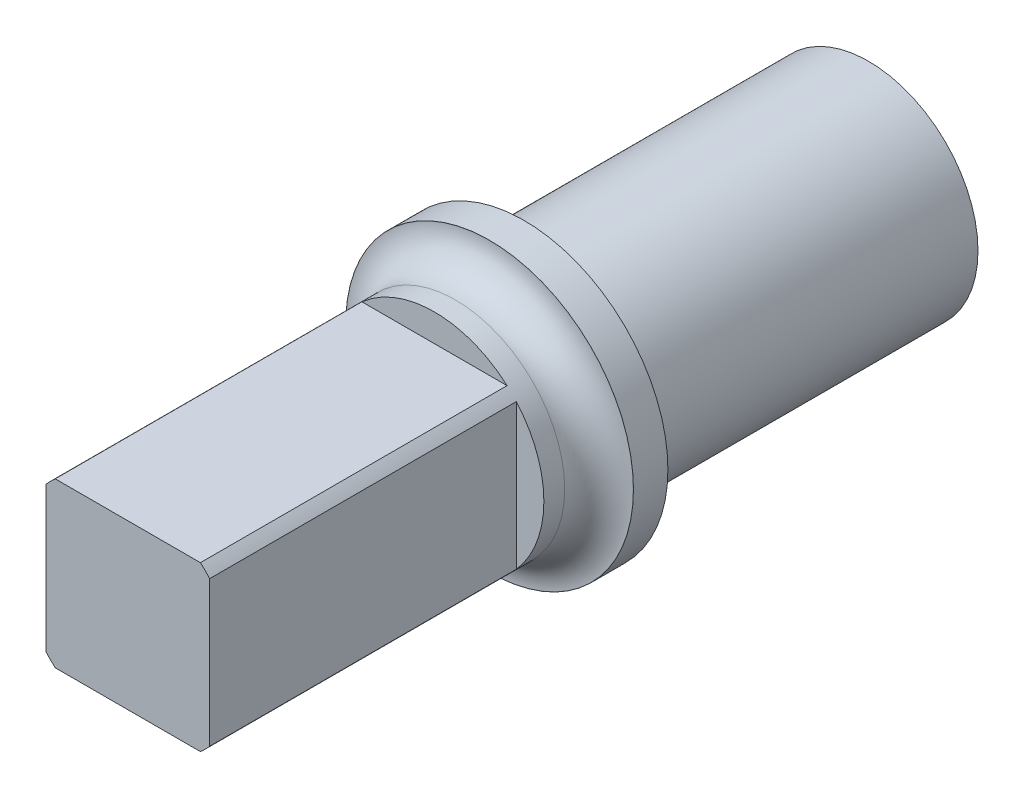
SolidWorks part; units mm, degrees
ref_plane "Спереди" through (0, 0, 0) normal (0, 0, 1) x (1, 0, 0)
ref_plane "Сверху" through (0, 0, 0) normal (0, 1, 0) x (1, 0, 0)
ref_plane "Справа" through (0, 0, 0) normal (1, 0, 0) x (0, 0, -1)
sketch "Эскиз1" plane through (0, 0, 0) normal (1, 0, 0) x (0, 0, -1)
  line L0 (0, 0) -> (43, 0)
  line L1 (43, 0) -> (43, 6.35)
  line L2 (43, 6.35) -> (23, 6.35)
  line L3 (23, 6.35) -> (23, 8.35)
  line L4 (23, 8.35) -> (21, 8.35)
  line L5 (21, 8.35) -> (21, 8.34)
  line L6 (19.01, 6.35) -> (0, 6.35)
  line L7 (0, 6.35) -> (0, 0)
  arc A0 (21, 8.34) -> (19.01, 6.35) centre (19.01, 8.34) cw
  dimension "D3" = 1.99
  dimension "D1" = 43
  dimension "D2" = 20
  dimension "D4" = 6.35
  dimension "D5" = 8.35
  dimension "D6" = 2
revolve "Повернуть2" add sketch "Эскиз1" angle 360 about L0
sketch "Эскиз3" plane through (0, 0, 0) normal (0, 0, 1) x (1, 0, 0)
  line L1 (4.75, 4.75) -> (-4.75, 4.75)
  line L2 (4.75, 4.75) -> (4.75, -4.75)
  line L3 (4.75, -4.75) -> (-4.75, -4.75)
  line L4 (-4.75, 4.75) -> (-4.75, -4.75)
  line L5 (4.75, 4.75) -> (-4.75, -4.75) construction
  line L6 (4.75, -4.75) -> (-4.75, 4.75) construction
  point P0 (0, 0)
  dimension "D1" = 9.5
extrude "Вырез-Вытянуть1" cut sketch "Эскиз3" against normal blind 17.8 flip side to cut
